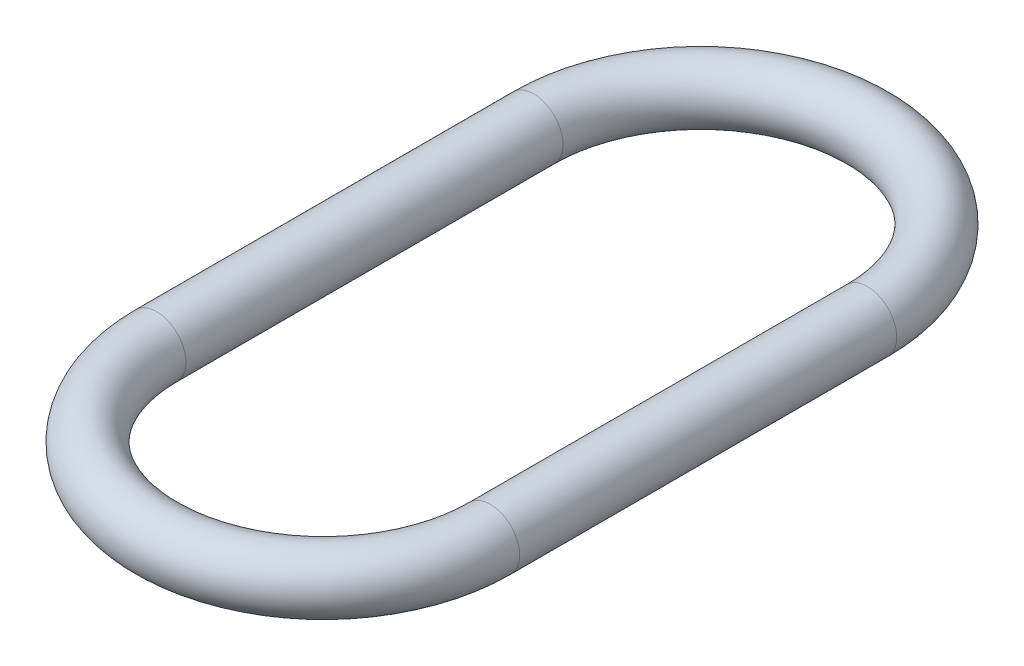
SolidWorks part; units mm, degrees
ref_plane "Front" through (0, 0, 0) normal (0, 0, 1) x (1, 0, 0)
ref_plane "Top" through (0, 0, 0) normal (0, 1, 0) x (1, 0, 0)
ref_plane "Right" through (0, 0, 0) normal (1, 0, 0) x (0, 0, -1)
sketch "Sketch1" plane through (0, 0, 0) normal (0, -1, 0) x (0, 0, -1)
  line L1 (0, 0) -> (-282.5, 0)
  line L3 (0, -250) -> (-282.5, -250)
  arc A0 (-282.5, 0) -> (-282.5, -250) centre (-282.5, -125) ccw
  arc A1 (0, -250) -> (0, 0) centre (0, -125) ccw
  dimension "D1" = 125
  dimension "D2" = 282.5
surface "Surface-Sweep1" parameters "D2"=44
